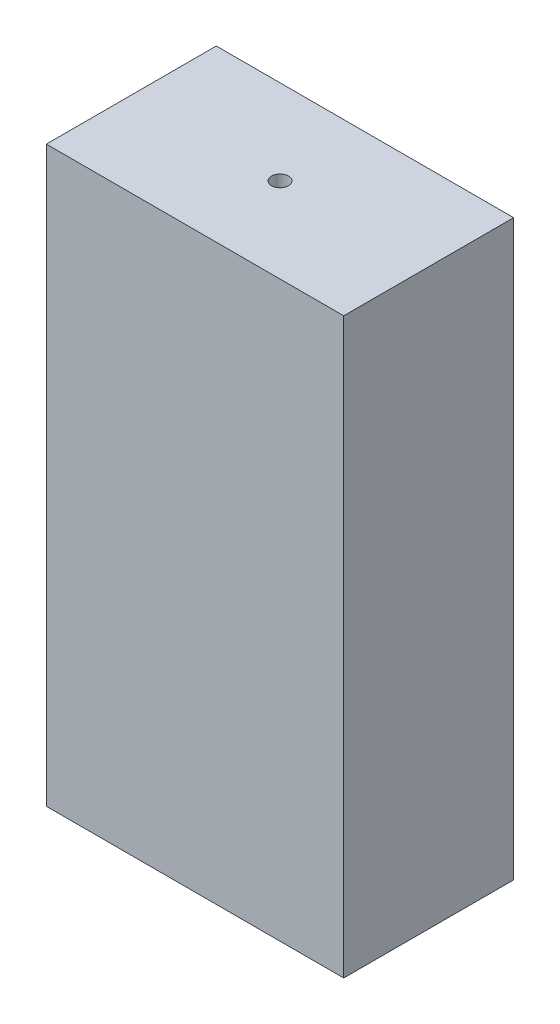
SolidWorks part; units mm, degrees
ref_plane "Front Plane" through (0, 0, 0) normal (0, 0, 1) x (1, 0, 0)
ref_plane "Top Plane" through (0, 0, 0) normal (0, 1, 0) x (1, 0, 0)
ref_plane "Right Plane" through (0, 0, 0) normal (1, 0, 0) x (0, 0, -1)
sketch "Sketch1" plane through (0, 0, 0) normal (0, 1, 0) x (1, 0, 0)
  line L1 (-44.45, 25.4) -> (44.45, 25.4)
  line L2 (-44.45, 25.4) -> (-44.45, -25.4)
  line L3 (-44.45, -25.4) -> (44.45, -25.4)
  line L4 (44.45, 25.4) -> (44.45, -25.4)
  line L5 (-44.45, 25.4) -> (44.45, -25.4) construction
  line L6 (-44.45, -25.4) -> (44.45, 25.4) construction
  point P0 (0, 0)
  dimension "D1" = 88.9
  dimension "D2" = 50.8
extrude "Boss-Extrude1" add sketch "Sketch1" along normal blind 171.45
sketch "Sketch2" plane through (0, 171.45, 0) normal (0, 1, 0) x (1, 0, 0)
  point P0 (0, 0)
hole_wizard "#8 (0.199) Diameter Hole1" positions "Sketch3" profile "Sketch4" hole size "#8" standard "ANSI Inch"
sketch "Sketch3" plane through (0, 171.45, 0) normal (0, 1, 0) x (1, 0, 0)
  point P0 (0, 0)
sketch "Sketch4" plane through (0, 171.45, 0) normal (1, 0, 0) x (0, 0, 1)
  line L0 (0, 0) -> (0, 26.9186)
  line L1 (0, 26.9186) -> (2.5273, 25.4)
  line L2 (2.5273, 25.4) -> (2.5273, 0)
  line L5 (2.5273, 0) -> (0, 0)
  line L10 (0, 26.9186) -> (-2.5273, 25.4) construction
  line L11 (0, -6.35) -> (0, 107.95) construction
  dimension "Hole Dia." = 5.0546
  dimension "Hole Depth" = 25.4
  dimension "Drill Angle" = 118
